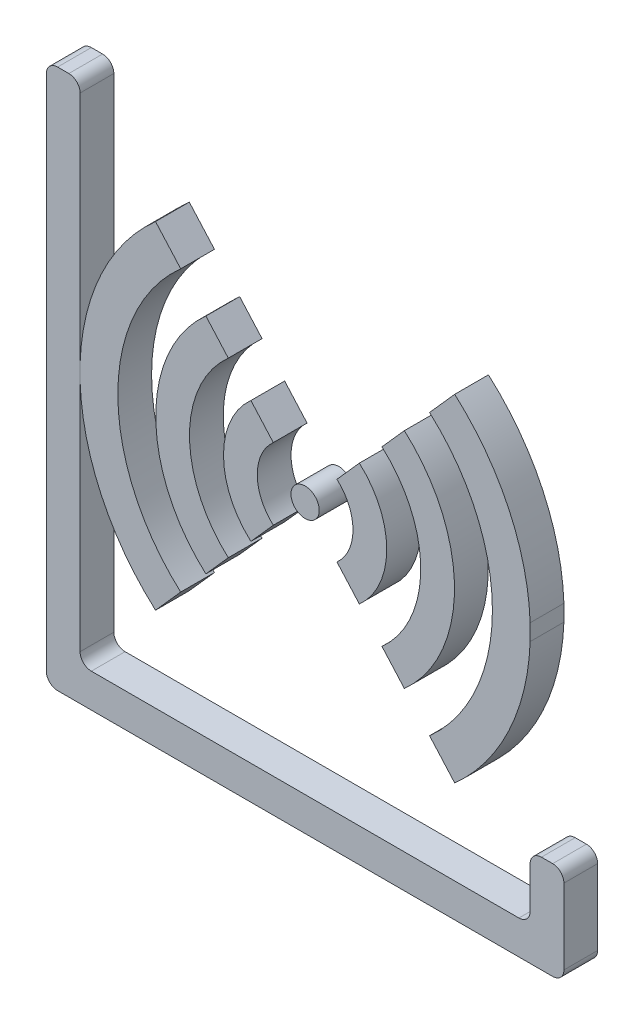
SolidWorks part; units mm, degrees
ref_plane "Front Plane" through (0, 0, 0) normal (0, 0, 1) x (1, 0, 0)
ref_plane "Top Plane" through (0, 0, 0) normal (0, 1, 0) x (1, 0, 0)
ref_plane "Right Plane" through (0, 0, 0) normal (1, 0, 0) x (0, 0, -1)
sketch "Sketch1" plane through (0, 0, 0) normal (0, 0, 1) x (1, 0, 0)
  line L0 (-4.255, 0) -> (-7.255, 0) construction
  line L1 (20, 0.7243) -> (20, -0.7243)
  line L2 (-20, 22.5) -> (-20, -22.5)
  line L3 (-20, -22.5) -> (20, -22.5)
  line L4 (20, 22.5) -> (20, 22.1739)
  line L5 (-20, 22.5) -> (20, -22.5) construction
  line L6 (-20, -22.5) -> (20, 22.5) construction
  line L7 (-7.2035, -0.8624) -> (-10.2035, -1.2216) construction
  line L8 (-9.4665, -3.9988) -> (-12.23, -5.1662) construction
  line L9 (-11.8246, -6.0368) -> (-14.8246, -7.5684) construction
  line L10 (-14.8246, -7.5684) -> (-17.8246, -9.1) construction
  line L11 (-13.296, -14.958) -> (-11.0582, -12.4404)
  line L12 (-8.8204, -9.9229) -> (-6.8273, -7.6807)
  line L13 (-6.8273, -7.6807) -> (-6.8669, -7.6995)
  line L14 (-13.296, 14.958) -> (-11.0582, 12.4404)
  line L15 (-8.8204, 9.9229) -> (-6.8273, 7.6807)
  line L16 (13.296, 14.958) -> (11.0582, 12.4404)
  line L17 (8.8204, 9.9229) -> (6.8273, 7.6807)
  line L18 (13.296, -14.958) -> (11.0582, -12.4404)
  line L19 (8.8204, -9.9229) -> (6.8273, -7.6807)
  line L20 (-2.8269, 3.1802) -> (-4.82, 5.4224)
  line L21 (2.8269, 3.1802) -> (4.82, 5.4224)
  line L22 (4.82, -5.4224) -> (2.8269, -3.1802)
  line L23 (-2.8269, -3.1802) -> (-4.82, -5.4224)
  line L24 (-1.255, 0) -> (-4.255, 0) construction
  line L25 (-20, 0) -> (-23, 0) construction
  line L26 (20, -16.8154) -> (20, -22.5)
  line L27 (-23, 25.5) -> (-23, -25.5)
  line L28 (-23, -25.5) -> (23, -25.5)
  line L29 (23, -16.8154) -> (23, -25.5)
  line L30 (-23, 25.5) -> (23, -25.5) construction
  line L31 (-23, -25.5) -> (23, 25.5) construction
  line L32 (0, -22.5) -> (0, -25.5) construction
  line L33 (20, -16.8154) -> (23, -16.8154)
  line L34 (-20, 22.5) -> (-23, 22.5)
  arc A0 (-13.296, 14.958) -> (-13.296, -14.958) centre (0, 0) ccw
  arc A1 (-11.0582, 12.4404) -> (-11.0582, -12.4404) centre (0, 0) ccw
  arc A2 (-8.8204, 9.9229) -> (-8.8204, -9.9229) centre (0, 0) ccw
  arc A3 (-6.8273, 7.6807) -> (-6.8273, -7.6807) centre (0, 0) ccw
  arc A4 (-4.82, 5.4224) -> (-4.82, -5.4224) centre (0, 0) ccw
  arc A5 (-2.8269, 3.1802) -> (-2.8269, -3.1802) centre (0, 0) ccw
  arc A6 (4.82, -5.4224) -> (4.82, 5.4224) centre (0, 0) ccw
  arc A7 (6.8273, -7.6807) -> (6.8273, 7.6807) centre (0, 0) ccw
  arc A8 (8.8204, -9.9229) -> (8.8204, 9.9229) centre (0, 0) ccw
  arc A9 (11.0582, -12.4404) -> (11.0582, 12.4404) centre (0, 0) ccw
  arc A10 (13.296, -14.958) -> (13.296, 14.958) centre (0, 0) ccw
  arc A11 (2.8269, -3.1802) -> (2.8269, 3.1802) centre (0, 0) ccw
  circle A12 centre (0, 0) radius 1.255
  point P0 (0, 0)
  dimension "D3" = 3
  dimension "D8" = 3
  dimension "D1" = 40
  dimension "D2" = 45
  dimension "D4" = 3
  dimension "D5" = 3
  dimension "D6" = 3
  dimension "D7" = 3
  dimension "D9" = 3
  dimension "D10" = 3
extrude "Boss-Extrude1" add sketch "Sketch1" along normal blind 3
fillet "Fillet1" radius 1 8 edges at (-23, 22.5, 1.5) (-20, 22.5, 1.5) (-20, -22.5, 1.5) (-23, -25.5, 1.5) (20, -22.5, 1.5) (23, -25.5, 1.5) (23, -16.8154, 1.5) (20, -16.8154, 1.5)
